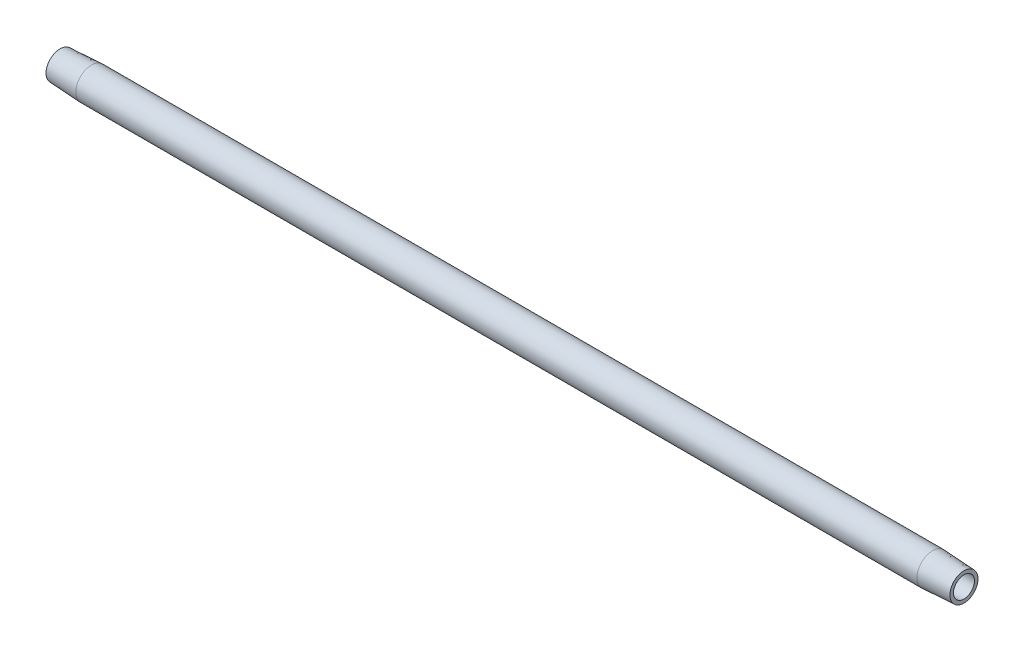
SolidWorks part; units mm, degrees
ref_plane "Front Plane" through (0, 0, 0) normal (0, 0, 1) x (1, 0, 0)
ref_plane "Top Plane" through (0, 0, 0) normal (0, 1, 0) x (1, 0, 0)
ref_plane "Right Plane" through (0, 0, 0) normal (1, 0, 0) x (0, 0, -1)
sketch "Sketch2" plane through (0, 0, 0) normal (0, 0, 1) x (1, 0, 0)
  line L0 (0.4761, 0) -> (50000.4761, 0) construction
  line L1 (0, -11.3625) -> (0, 49988.6375) construction
  line L7 (7.9375, 3.9687) -> (0, 3.5528)
  line L8 (220.6625, 3.9688) -> (7.9375, 3.9687)
  line L9 (228.6, 3.5528) -> (220.6625, 3.9688)
  line L10 (228.6, 2.6543) -> (228.6, 3.5528)
  line L11 (228.6, 2.6543) -> (0, 2.6543)
  line L12 (0, 3.5528) -> (0, 2.6543)
  dimension "D1" = 5.3086
  dimension "D2" = 7.9375
  dimension "D3" = 3
  dimension "D4" = 3
  dimension "D5" = 7.9375
  dimension "D6" = 7.9375
  dimension "D7" = 228.6
revolve "Revolve1" add sketch "Sketch2" angle 360 about L0
